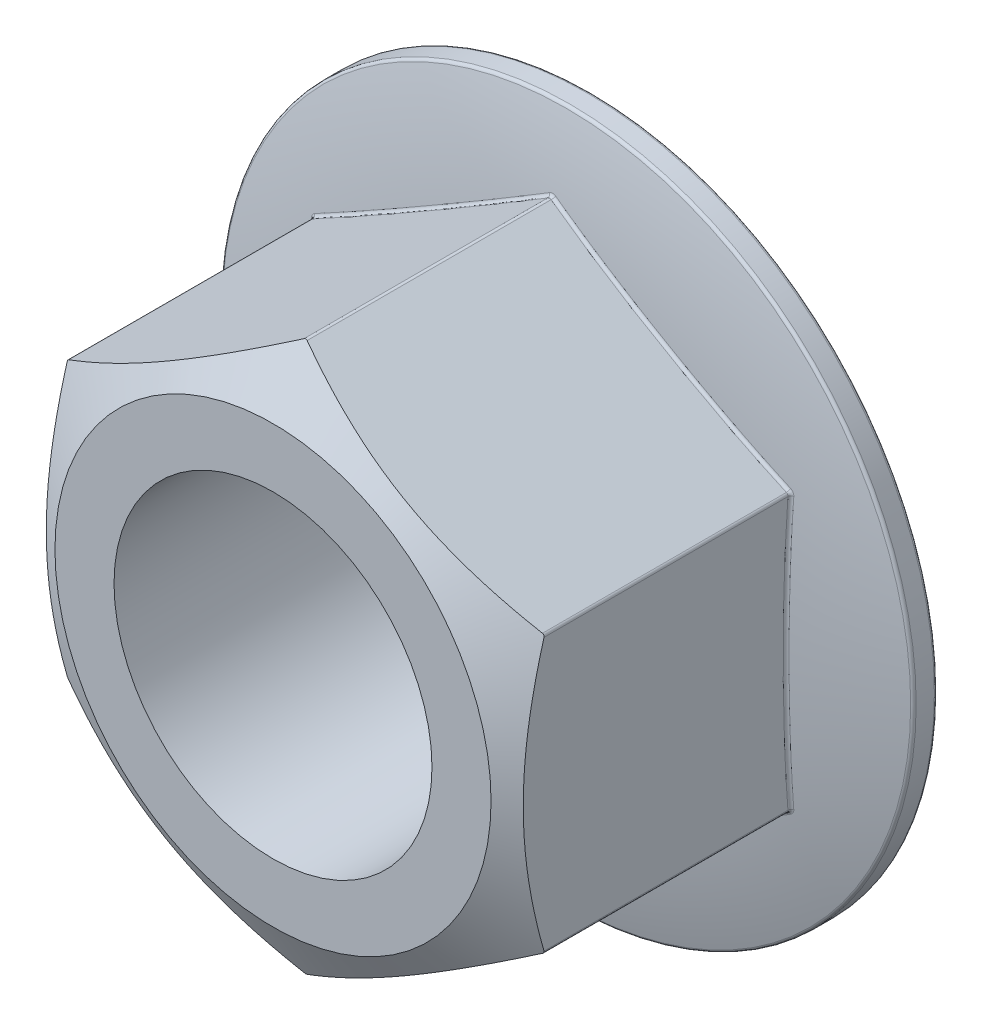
SolidWorks part; units mm, degrees
other "Fillet1"
ref_plane "Front Plane" through (0, 0, 0) normal (0, 0, 1) x (1, 0, 0)
ref_plane "Top Plane" through (0, 0, 0) normal (0, 1, 0) x (1, 0, 0)
ref_plane "Right Plane" through (0, 0, 0) normal (1, 0, 0) x (0, 0, -1)
imported_body "Imported1"
sketch "Sketch1" plane through (0, 0, 0) normal (0, 0, 1) x (1, 0, 0)
  circle A0 centre (0, 0) radius 6.858
  dimension "D1" = 13.716
extrude "Cut-Extrude1" cut sketch "Sketch1" against normal blind 2.54 draft 60 flip side to cut
